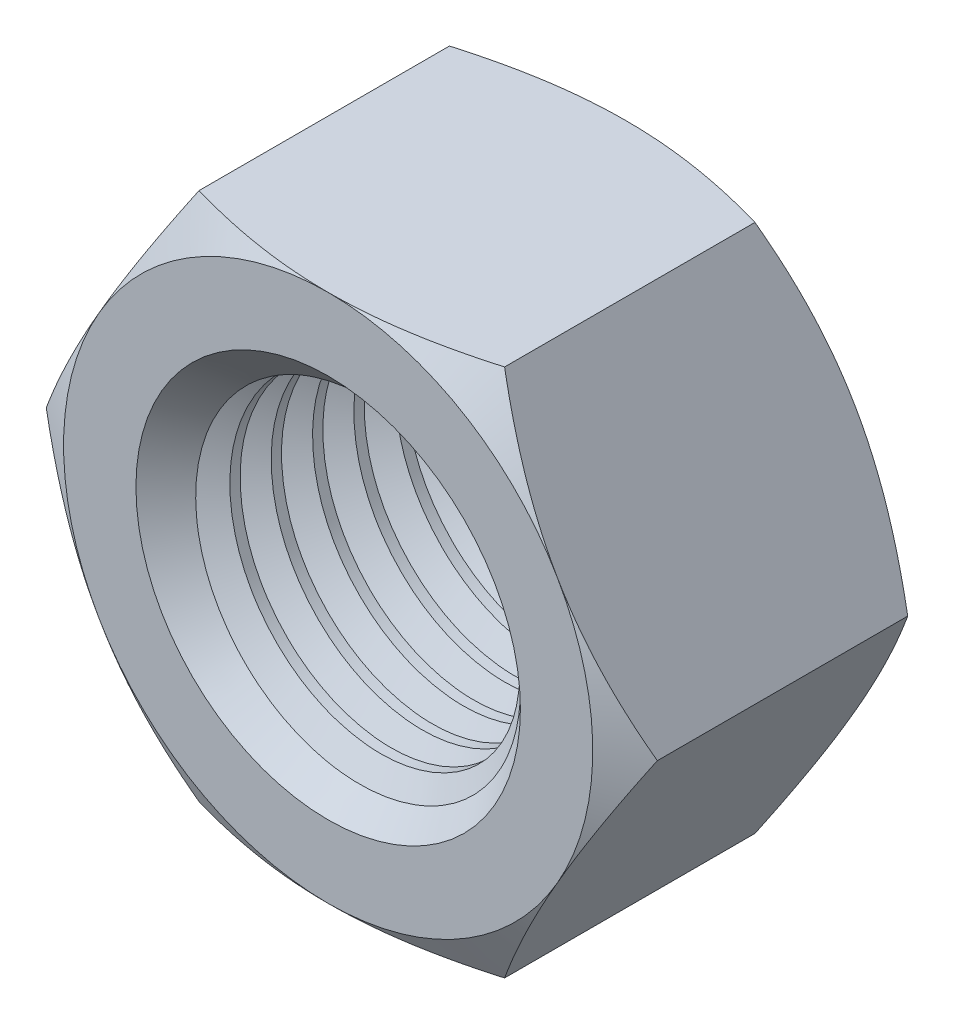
SolidWorks part; units mm, degrees
ref_plane "Front" through (0, 0, 0) normal (0, 0, 1) x (1, 0, 0)
ref_plane "Top" through (0, 0, 0) normal (0, 1, 0) x (1, 0, 0)
ref_plane "Right" through (0, 0, 0) normal (1, 0, 0) x (0, 0, -1)
sketch "Çizim2" plane through (0, 0, 0) normal (0, 0, 1) x (1, 0, 0)
  line L1 (18.4752, 0) -> (9.2376, 16)
  line L2 (9.2376, 16) -> (-9.2376, 16)
  line L3 (-9.2376, 16) -> (-18.4752, 0)
  line L4 (-18.4752, 0) -> (-9.2376, -16)
  line L5 (-9.2376, -16) -> (9.2376, -16)
  line L6 (9.2376, -16) -> (18.4752, 0)
  circle A0 centre (0, 0) radius 16 construction
  point P1 (0, 0)
  dimension "D1" = 32
extrude "Yükseklik-Ekstrüzyon1" add sketch "Çizim2" along normal blind 18
sketch "Çizim3" plane through (0, 0, 18) normal (0, 0, 1) x (1, 0, 0)
  circle A0 centre (0, 0) radius 16
extrude "Kes-Ekstrüzyon1" cut sketch "Çizim3" against normal blind 18 draft 60 flip side to cut
sketch "Çizim4" plane through (0, 0, 0) normal (0, 0, -1) x (-1, 0, 0)
  circle A0 centre (0, 0) radius 16
extrude "Kes-Ekstrüzyon2" cut sketch "Çizim4" against normal blind 18 draft 60 flip side to cut
sketch "Çizim5" plane through (0, 0, 0) normal (0, 0, -1) x (-1, 0, 0)
  circle A0 centre (0, 0) radius 9.375
  dimension "D1" = 18.75
extrude "Kes-Ekstrüzyon3" cut sketch "Çizim5" against normal blind 18 contours A0
chamfer "Pah1" distance 2.25 angle 45 2 edges at (-9.375, 0, 18) (-9.375, 0, 0)
sketch "Çizim6" plane through (0, 0, 18) normal (0, 0, 1) x (1, 0, 0)
  circle A0 centre (0, 0) radius 9.375
curve "Helis/Spiral2"
ref_plane "Düzlem1" through (-2.897, -8.9162, -4) normal (-0.9502, 0.3087, -0.0424) x (-0.0403, 0.0131, 0.9991)
sketch "Çizim7" plane through (-2.897, -8.9162, -4) normal (-0.9502, 0.3087, -0.0424) x (-0.0403, 0.0131, 0.9991)
  line L0 (1.2293, 0.5042) -> (-1.2293, 0.5042)
  line L1 (0, -1.625) -> (1.2293, 0.5042)
  line L3 (-1.2293, 0.5042) -> (0, -1.625)
  line L5 (1.4073, 0.8125) -> (0, 0.8125)
  circle A0 centre (0, 0) radius 0.8125 construction
  dimension "D1" = 1.625
sweep "Kes-Süpür1" cut profiles "Çizim7" path "Helis/Spiral2"
